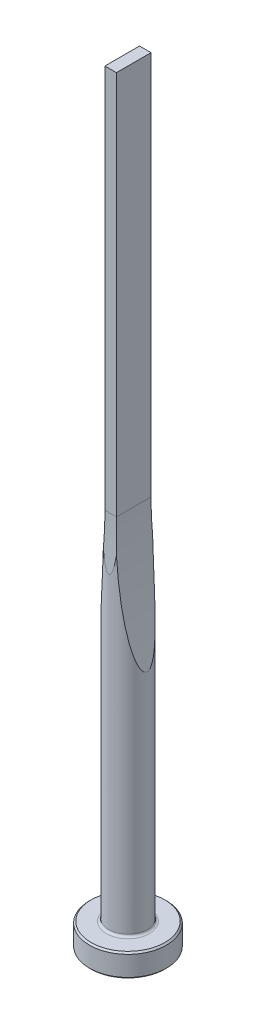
SolidWorks part; units mm, degrees
ref_plane "Front Plane" through (0, 0, 0) normal (0, 0, 1) x (1, 0, 0)
ref_plane "Top Plane" through (0, 0, 0) normal (0, 1, 0) x (1, 0, 0)
ref_plane "Right Plane" through (0, 0, 0) normal (1, 0, 0) x (0, 0, -1)
sketch "Sketch1" plane through (0, 0, 0) normal (0, 0, 1) x (1, 0, 0)
  line L0 (0, 0) -> (4.8, 0)
  line L1 (55, 0) -> (-55, 0) construction
  line L2 (5, 0.2) -> (5, 2.8)
  line L3 (4.8, 3) -> (2.8, 3)
  line L4 (2.5, 3.3) -> (2.5, 100)
  line L5 (0, 100) -> (2.5, 100)
  line L6 (5, 2.8) -> (4.8, 3)
  line L7 (4.8, 0) -> (5, 0.2)
  line L8 (0, 100) -> (0, 0)
  arc A0 (2.5, 3.3) -> (2.8, 3) centre (2.8, 3.3) ccw
  point P1 (5, 0)
  point P6 (5, 3)
  dimension "D4" = 0.3
  dimension "D1" = 2.5
  dimension "D2" = 5
  dimension "D3" = 3
  dimension "D5" = 100
revolve "Revolve1" add sketch "Sketch1" angle 360 about L8
sketch "Sketch2" plane through (0, 0, 0) normal (0, 0, 1) x (1, 0, 0)
  line L0 (0.75, 100) -> (0.75, 50)
  line L1 (2.5, 100) -> (-2.5, 100) construction
  line L2 (-0.75, 100) -> (-0.75, 50)
  line L3 (2.5, 100) -> (2.5, 32.3382)
  line L4 (-2.5, 100) -> (-2.5, 32.3382)
  line L5 (0, -5.5) -> (0, 5.5) construction
  line L6 (2.5, 100) -> (0.75, 100)
  line L8 (-0.75, 100) -> (-2.5, 100)
  arc A0 (0.75, 50) -> (2.5, 32.3382) centre (90.75, 50) ccw
  arc A1 (-0.75, 50) -> (-2.5, 32.3382) centre (-90.75, 50) cw
  dimension "D4" = 90
  dimension "D1" = 50
  dimension "D2" = 1.5
  dimension "D3" = 0.75
extrude "Cut-Extrude1" cut sketch "Sketch2" against normal mid plane 10
sketch "Sketch3" plane through (0, 0, 0) normal (1, 0, 0) x (0, 0, -1)
  line L0 (2.25, 100) -> (2.25, 50)
  line L1 (-2.3848, 100) -> (2.3848, 100) construction
  line L2 (-2.25, 100) -> (-2.25, 50)
  line L3 (2.5, 100) -> (2.5, 43.2965)
  line L4 (2.25, 100) -> (2.5, 100)
  line L5 (0, 5.5) -> (0, -5.5) construction
  line L6 (-2.5, 100) -> (-2.5, 43.2965)
  line L8 (-2.25, 100) -> (-2.5, 100)
  arc A0 (2.25, 50) -> (2.5, 43.2965) centre (92.25, 50) ccw
  arc A1 (-2.25, 50) -> (-2.5, 43.2965) centre (-92.25, 50) cw
  dimension "D2" = 90
  dimension "D1" = 50
  dimension "D3" = 4.5
  dimension "D4" = 2.25
extrude "Cut-Extrude2" cut sketch "Sketch3" against normal mid plane 10
